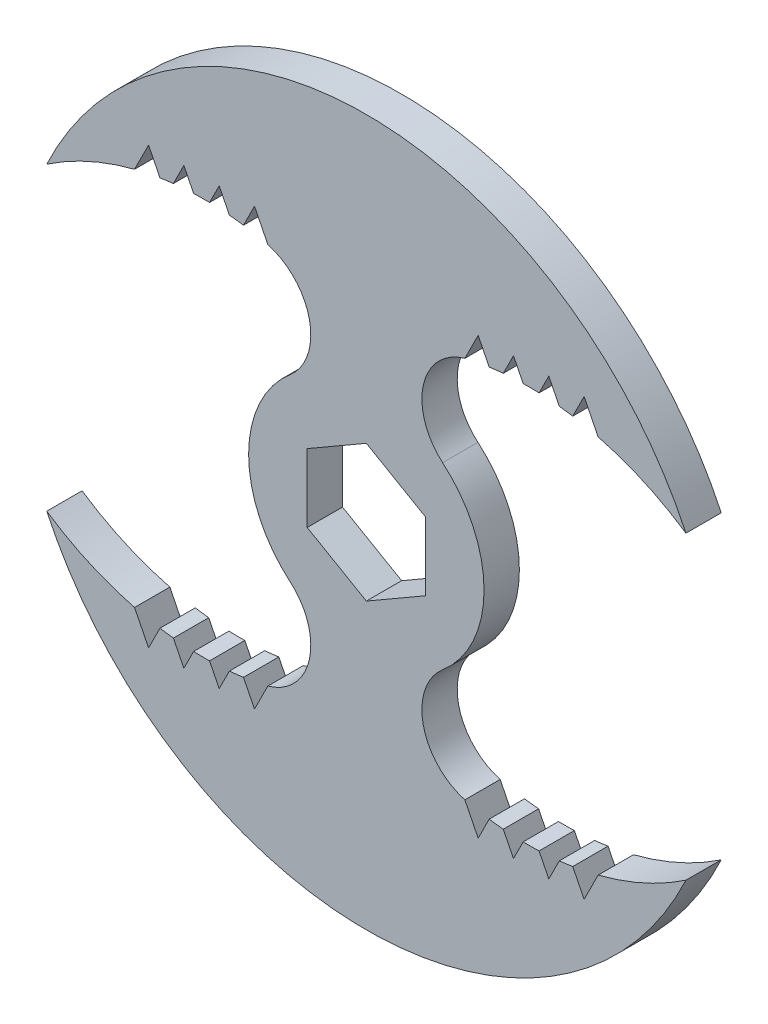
SolidWorks part; units mm, degrees
ref_plane "Plan de face" through (0, 0, 0) normal (0, 0, 1) x (1, 0, 0)
ref_plane "Plan de dessus" through (0, 0, 0) normal (0, 1, 0) x (1, 0, 0)
ref_plane "Plan de droite" through (0, 0, 0) normal (1, 0, 0) x (0, 0, -1)
sketch "Esquisse1" plane through (0, 0, 0) normal (0, 0, 1) x (1, 0, 0)
  line L0 (-90.1441, 0) -> (97.6301, 0) construction
  line L1 (0, 0) -> (0, 130.2567) construction
  line L2 (0, 0) -> (0, -110.8529) construction
  line L3 (0, 0) -> (-117.6421, 55.308) construction
  line L4 (0, 0) -> (-107.7446, -50.6548) construction
  line L5 (0, 0) -> (82.5368, 38.8037) construction
  line L6 (0, 0) -> (71.9549, -33.8287) construction
  line L8 (0, 11.6047) -> (-10.05, 5.8024)
  line L9 (-10.05, 5.8024) -> (-10.05, -5.8024)
  line L10 (-10.05, -5.8024) -> (0, -11.6047)
  line L11 (0, -11.6047) -> (10.05, -5.8024)
  line L12 (10.05, -5.8024) -> (10.05, 5.8024)
  line L13 (10.05, 5.8024) -> (0, 11.6047)
  line L14 (-51.5684, -37) -> (-29.5258, -37) construction
  line L15 (-39.3822, -32.2357) -> (-37, -37)
  line L16 (-37, -37) -> (-35.0653, -33.1307)
  line L18 (-29.3467, -33.6935) -> (-31, -37)
  line L19 (-31, -37) -> (-32.7805, -33.439)
  line L21 (-23.2685, -33.5369) -> (-25, -37)
  line L22 (-25, -37) -> (-26.6403, -33.7194)
  line L24 (-16.7393, -32.4787) -> (-19, -37)
  line L25 (-19, -37) -> (-20.8697, -33.2605)
  line L26 (-37, -42.0297) -> (-37, -25.5278) construction
  line L27 (-31, -41.0469) -> (-31, -25.5278) construction
  line L28 (-25, -42.0297) -> (-25, -16.5831) construction
  line L29 (-19, -42.2208) -> (-19, -30.1911) construction
  line L30 (14.3989, -37) -> (37, -37) construction
  line L32 (20.8697, -33.2605) -> (19, -37)
  line L33 (19, -37) -> (16.7393, -32.4787)
  line L35 (26.6403, -33.7194) -> (25, -37)
  line L36 (25, -37) -> (23.2685, -33.5369)
  line L38 (32.7805, -33.439) -> (31, -37)
  line L39 (31, -37) -> (29.3467, -33.6935)
  line L41 (39.3822, -32.2357) -> (37, -37)
  line L42 (37, -37) -> (35.0653, -33.1307)
  line L43 (19, -41.0469) -> (19, -26.9793) construction
  line L44 (25, -41.0469) -> (25, -26.9793) construction
  line L45 (31, -41.0469) -> (31, -26.9793) construction
  line L46 (37, -40.0106) -> (37, -25.5278) construction
  line L47 (-43.5871, 37) -> (-14.616, 37) construction
  line L49 (-35.0653, 33.1307) -> (-37, 37)
  line L50 (-37, 37) -> (-39.3822, 32.2357)
  line L53 (-29.3467, 33.6935) -> (-31, 37)
  line L54 (-31, 37) -> (-32.7805, 33.439)
  line L56 (-23.2685, 33.5369) -> (-25, 37)
  line L57 (-25, 37) -> (-26.6403, 33.7194)
  line L59 (-16.7393, 32.4787) -> (-19, 37)
  line L60 (-19, 37) -> (-20.8697, 33.2605)
  line L61 (-37, 41.5409) -> (-37, 27.4795) construction
  line L62 (-31, 42.5993) -> (-31, 27.4795) construction
  line L63 (-31, 27.4795) -> (-31.0235, 27.4795) construction
  line L64 (-25, 42.5993) -> (-25, 27.4795) construction
  line L65 (-19, 42.5993) -> (-19, 27.4795) construction
  line L66 (16, 37) -> (43.5082, 37) construction
  line L68 (20.8697, 33.2605) -> (19, 37)
  line L69 (19, 37) -> (16.7393, 32.4787)
  line L71 (26.6403, 33.7194) -> (25, 37)
  line L72 (25, 37) -> (23.2685, 33.5369)
  line L74 (32.7805, 33.439) -> (31, 37)
  line L75 (31, 37) -> (29.3467, 33.6935)
  line L77 (39.3822, 32.2357) -> (37, 37)
  line L78 (37, 37) -> (35.0653, 33.1307)
  line L79 (19, 41.5409) -> (19, 25.5278) construction
  line L80 (25, 41.5409) -> (25, 25.5278) construction
  line L81 (31, 41.5409) -> (31, 25.5278) construction
  line L82 (37, 37) -> (37, 41.5409) construction
  line L83 (37, 41.5409) -> (37, 27.4795) construction
  arc A0 (54.2985, -25.5278) -> (-54.2985, -25.5278) centre (0, 0) cw
  arc A1 (-54.2985, 25.5278) -> (54.2985, 25.5278) centre (0, 0) cw
  arc A2 (-12.9594, -15.2333) -> (-12.9594, 15.2333) centre (0, 0) cw
  arc A3 (12.9594, -15.2333) -> (12.9594, 15.2333) centre (0, 0) ccw
  circle A4 centre (0, 0) radius 10.05 construction
  circle A5 centre (0, 0) radius 30 construction
  arc A6 (-12.9594, 15.2333) -> (-16.7393, 32.4787) centre (-19.4391, 22.85) ccw
  arc A7 (16.7393, 32.4787) -> (12.9594, 15.2333) centre (19.4391, 22.85) ccw
  arc A8 (12.9594, -15.2333) -> (16.7393, -32.4787) centre (19.4391, -22.85) ccw
  arc A9 (-16.7393, -32.4787) -> (-12.9594, -15.2333) centre (-19.4391, -22.85) ccw
  arc A10 (-20.8697, 33.2605) -> (-23.2685, 33.5369) centre (-27.5353, -14.0472) ccw
  arc A11 (54.2985, 25.5278) -> (39.3822, 32.2357) centre (27.5353, -14.0472) ccw
  arc A12 (-35.0653, -33.1307) -> (-32.7805, -33.439) centre (-27.5353, 14.0472) ccw
  arc A13 (-54.2985, -25.5278) -> (-39.3822, -32.2357) centre (-27.5353, 14.0472) ccw
  arc A14 (-39.3822, 32.2357) -> (-54.2985, 25.5278) centre (-27.5353, -14.0472) ccw
  arc A15 (-32.7805, 33.439) -> (-35.0653, 33.1307) centre (-27.5353, -14.0472) ccw
  arc A16 (-26.6403, 33.7194) -> (-29.3467, 33.6935) centre (-27.5353, -14.0472) ccw
  arc A17 (23.2685, 33.5369) -> (20.8697, 33.2605) centre (27.5353, -14.0472) ccw
  arc A18 (29.3467, 33.6935) -> (26.6403, 33.7194) centre (27.5353, -14.0472) ccw
  arc A19 (35.0653, 33.1307) -> (32.7805, 33.439) centre (27.5353, -14.0472) ccw
  arc A20 (39.3822, -32.2357) -> (54.2985, -25.5278) centre (27.5353, 14.0472) ccw
  arc A21 (32.7805, -33.439) -> (35.0653, -33.1307) centre (27.5353, 14.0472) ccw
  arc A22 (26.6403, -33.7194) -> (29.3467, -33.6935) centre (27.5353, 14.0472) ccw
  arc A23 (20.8697, -33.2605) -> (23.2685, -33.5369) centre (27.5353, 14.0472) ccw
  arc A24 (-29.3467, -33.6935) -> (-26.6403, -33.7194) centre (-27.5353, 14.0472) ccw
  arc A25 (-23.2685, -33.5369) -> (-20.8697, -33.2605) centre (-27.5353, 14.0472) ccw
  point P26 (-19.4391, 22.85)
  point P27 (19.4391, 22.85)
  point P28 (19.4391, -22.85)
  point P29 (-19.4391, -22.85)
  dimension "D1" = 60
  dimension "D2" = 60
  dimension "D7" = 20
  dimension "D8" = 20
  dimension "D10" = 60
  dimension "D13" = 20
  dimension "D14" = 20
  dimension "D15" = 20
  dimension "D16" = 20
  dimension "D17" = 95.55
  dimension "D18" = 95.55
  dimension "D3" = 25.18
  dimension "D4" = 25.18
  dimension "D5" = 25.18
  dimension "D6" = 25.18
  dimension "D9" = 20.1
  dimension "D11" = 45.7
  dimension "D12" = 45.7
  dimension "D20" = 37
  dimension "D25" = 53.13
  dimension "D26" = 19
  dimension "D29" = 19
  dimension "D30" = 37
  dimension "D35" = 53.13
  dimension "D36" = 19
  dimension "D40" = 53.13
  dimension "D41" = 19
extrude "Extrusion1" add sketch "Esquisse1" along normal blind 6
